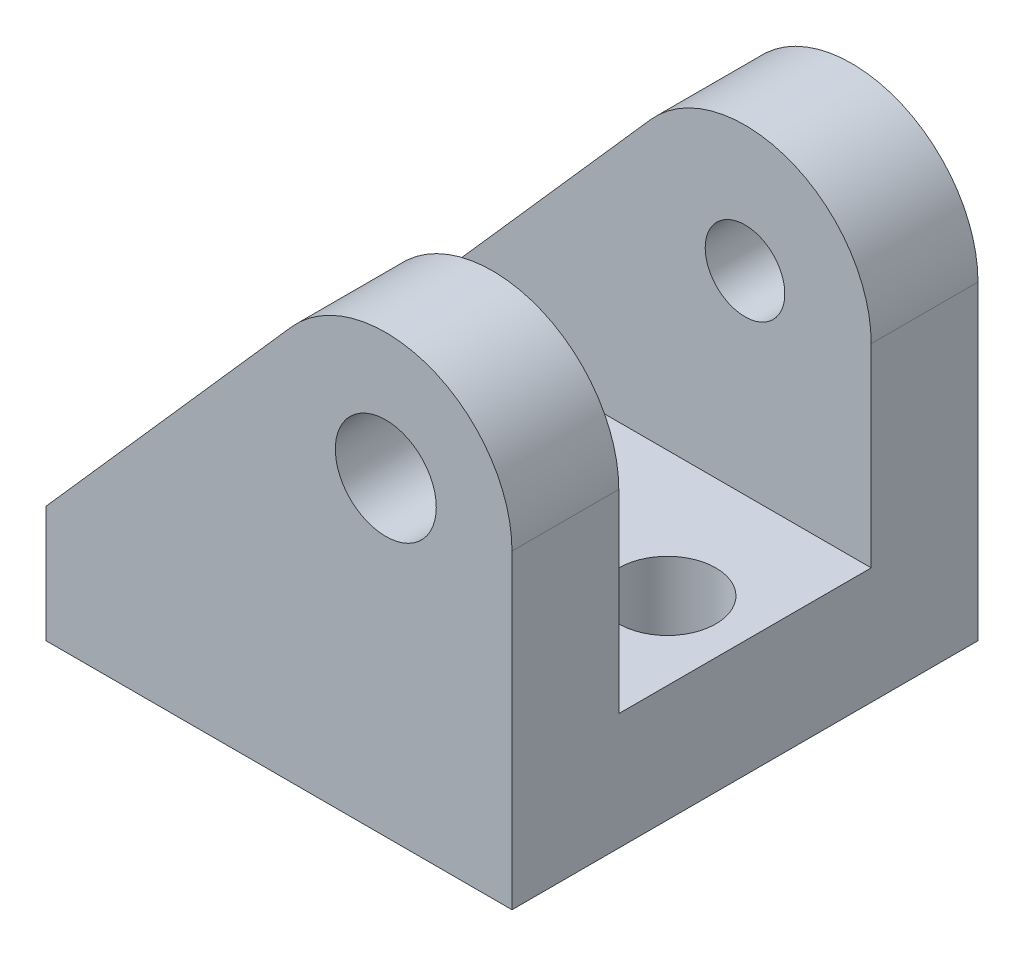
SolidWorks part; units mm, degrees
ref_plane "前视基准面" through (0, 0, 0) normal (0, 0, 1) x (1, 0, 0)
ref_plane "上视基准面" through (0, 0, 0) normal (0, 1, 0) x (1, 0, 0)
ref_plane "右视基准面" through (0, 0, 0) normal (1, 0, 0) x (0, 0, -1)
sketch "草图1" plane through (0, 0, 0) normal (0, 0, 1) x (1, 0, 0)
  line L0 (-110.7985, 0) -> (3.25, 0) construction
  line L1 (0, 80.7389) -> (0, -51.2574) construction
  line L2 (-2.4363, 10.151) -> (-8.75, 3)
  line L3 (-8.75, 3) -> (-8.75, 0)
  line L4 (-8.75, 0) -> (3.25, 0)
  line L5 (3.25, 8) -> (3.25, 0)
  line L6 (7.6752, 0) -> (119.8833, 0) construction
  arc A1 (3.25, 8) -> (-2.4363, 10.151) centre (0, 8) ccw
  dimension "D1" = 6.5
  dimension "D2" = 8
  dimension "D3" = 12
  dimension "D4" = 3
extrude "凸台-拉伸1" add sketch "草图1" along normal mid plane 12
ref_plane "基准面1" through (0, 3, 0) normal (0, -1, 0) x (-1, 0, 0)
sketch "草图2" plane through (0, 3, 0) normal (0, -1, 0) x (-1, 0, 0)
  line L0 (0, 0) -> (18.689, 0) construction
  line L1 (16.2843, 3.25) -> (-9.8322, 3.25)
  line L2 (16.2843, 3.25) -> (16.2843, -3.25)
  line L3 (16.2843, -3.25) -> (-9.8322, -3.25)
  line L4 (-9.8322, 3.25) -> (-9.8322, -3.25)
  line L5 (16.2843, 3.25) -> (-9.8322, -3.25) construction
  line L6 (16.2843, -3.25) -> (-9.8322, 3.25) construction
  point P0 (3.2261, 0)
  dimension "D1" = 6.5
extrude "切除-拉伸1" cut sketch "草图2" against normal blind 20
sketch "草图3" plane through (0, 0, 6) normal (0, 0, 1) x (1, 0, 0)
  circle A0 centre (0, 8) radius 1.3
  dimension "D1" = 2.6
extrude "切除-拉伸2" cut sketch "草图3" against normal blind 5
hole_wizard "M2.5 螺纹孔1" positions "3D草图1" profile "草图4" tap size "M2.5" standard "GB"
sketch3d "3D草图1"
  line L0 (0, 8, -3.25) -> (0, 8, -6) construction
  point P0 (0, 8, -6)
sketch "草图4" plane through (0, 8, -6) normal (1, 0, 0) x (0, 1, 0)
  line L0 (0, 0) -> (0, 7.8659)
  line L1 (0, 7.8659) -> (1.025, 7.25)
  line L2 (1.025, 7.25) -> (1.025, 0)
  line L5 (1.025, 0) -> (0, 0)
  line L10 (0, 7.8659) -> (-1.025, 7.25) construction
  line L11 (0, -6.35) -> (0, 107.95) construction
  dimension "螺纹孔钻头直径" = 2.05
  dimension "螺纹孔钻头深度" = 7.25
  dimension "导头角度" = 118
hole_wizard "M3 螺纹孔1" positions "3D草图2" profile "草图5" tap size "M3" standard "GB"
sketch3d "3D草图2"
  line L0 (-8.75, 0, 0) -> (11.2776, 0, 0) construction
  line L1 (-8.75, 0, 6) -> (-8.75, 0, -6) construction
  point P0 (-6.75, 0, 0)
  point P2 (1.25, 0, 0)
  dimension "D1" = 8
  dimension "D2" = 2
sketch "草图5" plane through (-6.75, 0, 0) normal (1, 0, 0) x (0, 0, -1)
  line L0 (0, 0) -> (0, 9.2511)
  line L1 (0, 9.2511) -> (1.25, 8.5)
  line L2 (1.25, 8.5) -> (1.25, 0)
  line L5 (1.25, 0) -> (0, 0)
  line L10 (0, 9.2511) -> (-1.25, 8.5) construction
  line L11 (0, -6.35) -> (0, 107.95) construction
  dimension "螺纹孔钻头直径" = 2.5
  dimension "螺纹孔钻头深度" = 8.5
  dimension "导头角度" = 118
